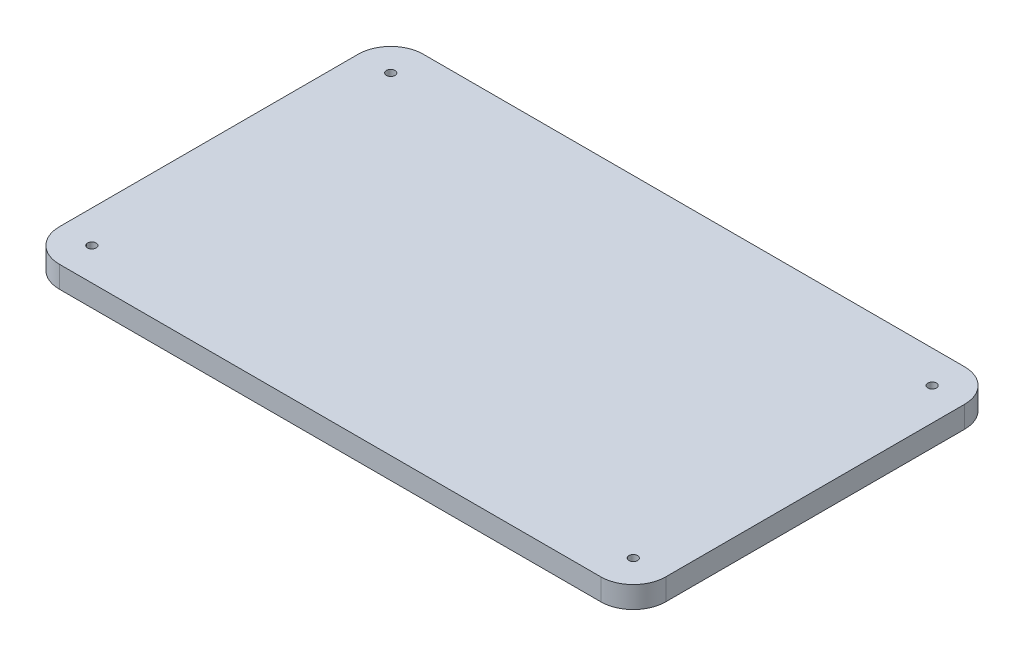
SolidWorks part; units mm, degrees
ref_plane "Front Plane" through (0, 0, 0) normal (0, 0, 1) x (1, 0, 0)
ref_plane "Top Plane" through (0, 0, 0) normal (0, 1, 0) x (1, 0, 0)
ref_plane "Right Plane" through (0, 0, 0) normal (1, 0, 0) x (0, 0, -1)
sketch "Sketch1" plane through (0, 0, 0) normal (0, 1, 0) x (1, 0, 0)
  line L0 (-3.4925, 0) -> (3.4925, 0) construction
  line L1 (79.375, 43.815) -> (-79.375, -43.815) construction
  line L2 (79.375, -43.815) -> (-79.375, 43.815) construction
  line L4 (88.9, -43.815) -> (88.9, 43.815)
  line L5 (-79.375, -53.34) -> (79.375, -53.34)
  line L6 (-88.9, 43.815) -> (-88.9, -43.815)
  line L7 (79.375, 53.34) -> (-79.375, 53.34)
  arc A4 (88.9, 43.815) -> (79.375, 53.34) centre (79.375, 43.815) ccw
  arc A5 (79.375, -53.34) -> (88.9, -43.815) centre (79.375, -43.815) ccw
  arc A6 (-88.9, -43.815) -> (-79.375, -53.34) centre (-79.375, -43.815) ccw
  arc A7 (-79.375, 53.34) -> (-88.9, 43.815) centre (-79.375, 43.815) ccw
  point P7 (0, 0)
  point P9 (0, 0)
  dimension "D3" = 9.525
  dimension "D1" = 158.75
  dimension "D2" = 87.63
extrude "Boss-Extrude1" add sketch "Sketch1" along normal blind 6.35
hole_wizard "#6-40 Tapped Hole2" positions "3DSketch2" profile "Sketch3" tap size "#6-40" standard "ANSI Inch"
sketch3d "3DSketch2"
  arc A3 (-79.375, 6.35, -53.34) -> (-88.9, 6.35, -43.815) centre (-79.375, 6.35, -43.815) ccw construction
  arc A4 (88.9, 6.35, -43.815) -> (79.375, 6.35, -53.34) centre (79.375, 6.35, -43.815) ccw construction
  arc A5 (79.375, 6.35, 53.34) -> (88.9, 6.35, 43.815) centre (79.375, 6.35, 43.815) ccw construction
  arc A6 (-88.9, 6.35, 43.815) -> (-79.375, 6.35, 53.34) centre (-79.375, 6.35, 43.815) ccw construction
  point P21 (79.375, 6.35, -43.815)
  point P23 (79.375, 6.35, 43.815)
  point P25 (-79.375, 6.35, -43.815)
  point P27 (-79.375, 6.35, 43.815)
  point P36 (-79.375, 15.875, -43.815)
  point P41 (79.375, 15.875, -43.815)
  point P46 (79.375, 15.875, 43.815)
  point P51 (-79.375, 15.875, 43.815)
sketch "Sketch3" plane through (79.375, 6.35, -43.815) normal (1, 0, 0) x (0, 0, 1)
  line L0 (0, 0) -> (0, 9.6785)
  line L1 (0, 9.6785) -> (1.27, 8.9154)
  line L2 (1.27, 8.9154) -> (1.27, 0)
  line L5 (1.27, 0) -> (0, 0)
  line L10 (0, 9.6785) -> (-1.27, 8.9154) construction
  line L11 (0, -6.35) -> (0, 107.95) construction
  dimension "Tap Drill Dia." = 2.54
  dimension "Tap Drill Depth" = 8.9154
  dimension "Drill Angle" = 118
